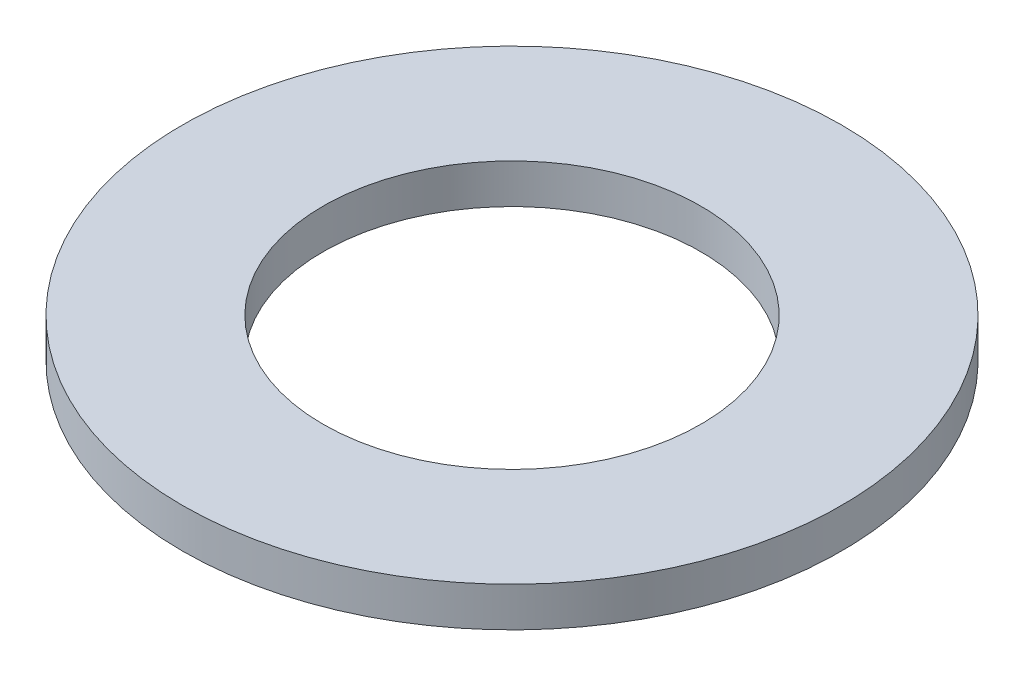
SolidWorks part; units mm, degrees
ref_plane "Front Plane" through (0, 0, 0) normal (0, 0, 1) x (1, 0, 0)
ref_plane "Top Plane" through (0, 0, 0) normal (0, 1, 0) x (1, 0, 0)
ref_plane "Right Plane" through (0, 0, 0) normal (1, 0, 0) x (0, 0, -1)
other "Configuration Table"
sketch "BaseSke" plane through (0, 0, 0) normal (0, 1, 0) x (1, 0, 0)
  circle A0 centre (0, 0) radius 2.15
  circle A1 centre (0, 0) radius 3.75
  dimension "Outer_dia" = 7.5
  dimension "Inner_dia" = 4.3
extrude "BaseBody" add sketch "BaseSke" along normal blind 0.45
